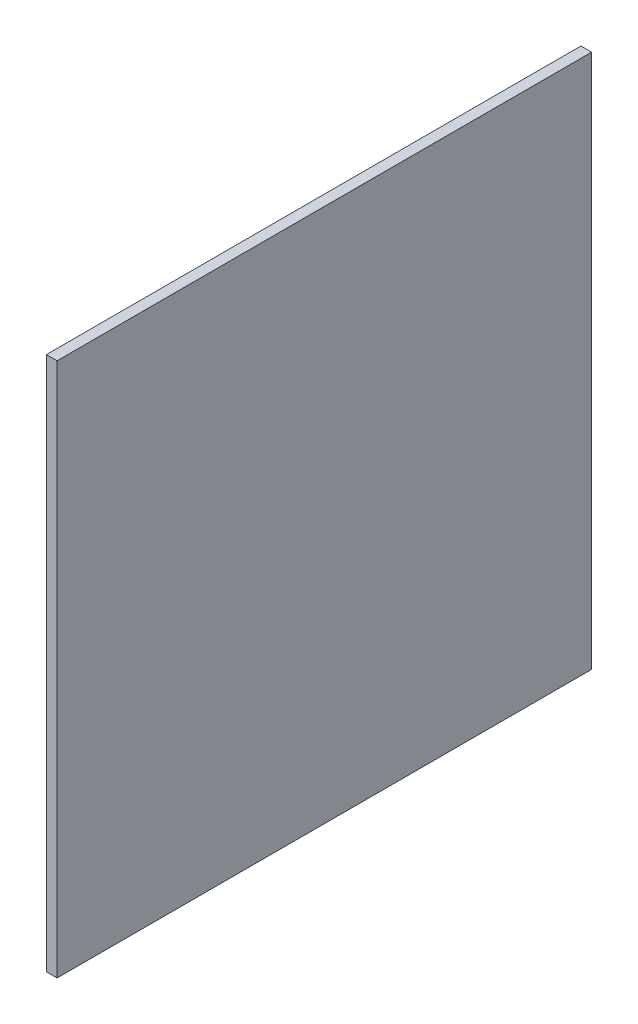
SolidWorks part; units mm, degrees
ref_plane "正面" through (0, 0, 0) normal (1, 0, 0) x (0, 1, 0)
ref_plane "平面" through (0, 0, 0) normal (0, 0, 1) x (0, 1, 0)
ref_plane "右側面" through (0, 0, 0) normal (0, 1, 0) x (-1, 0, 0)
sketch "ｽｹｯﾁ1" plane through (0, 0, 0) normal (1, 0, 0) x (0, 1, 0)
  line L1 (-250, 250) -> (250, 250)
  line L2 (-250, 250) -> (-250, -250)
  line L3 (-250, -250) -> (250, -250)
  line L4 (250, 250) -> (250, -250)
  line L5 (-250, 250) -> (250, -250) construction
  line L6 (-250, -250) -> (250, 250) construction
  point P0 (0, 0)
  dimension "D1" = 500
  dimension "D2" = 500
extrude "ﾎﾞｽ - 押し出し1" add sketch "ｽｹｯﾁ1" along normal blind 10
